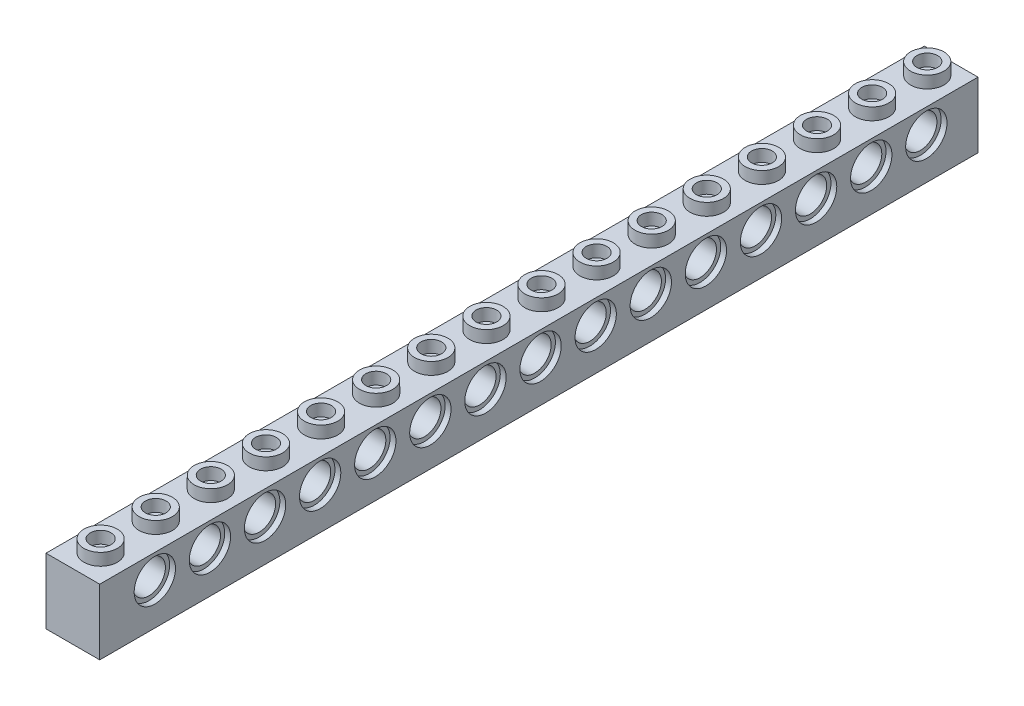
SolidWorks part; units mm, degrees
ref_plane "Front Plane" through (0, 0, 0) normal (0, 0, 1) x (1, 0, 0)
ref_plane "Top Plane" through (0, 0, 0) normal (0, 1, 0) x (1, 0, 0)
ref_plane "Right Plane" through (0, 0, 0) normal (1, 0, 0) x (0, 0, -1)
sketch "Sketch1" plane through (0, 0, 0) normal (0, 0, 1) x (1, 0, 0)
  line L1 (3.9, -4.76) -> (-3.9, -4.76)
  line L2 (3.9, -4.76) -> (3.9, 4.76)
  line L3 (3.9, 4.76) -> (-3.9, 4.76)
  line L4 (-3.9, -4.76) -> (-3.9, 4.76)
  line L5 (3.9, -4.76) -> (-3.9, 4.76) construction
  line L6 (3.9, 4.76) -> (-3.9, -4.76) construction
  point P0 (0, 0)
  dimension "D1" = 7.8
  dimension "D2" = 9.52
extrude "Boss-Extrude1" add sketch "Sketch1" along normal blind 127.5
sketch "Sketch2" plane through (0, 4.76, 0) normal (0, 1, 0) x (1, 0, 0)
  line L0 (0, -128.225) -> (0, 1.6736) construction
  line L1 (3.9, 0) -> (-3.9, 0) construction
  circle A0 centre (0, -3.47) radius 2.425
  circle A1 centre (0, -3.47) radius 1.5
  dimension "D1" = 4.85
  dimension "D2" = 3
  dimension "D3" = 3.47
extrude "Boss-Extrude3" add sketch "Sketch2" along normal blind 1.75
sketch "Sketch3" plane through (0, 4.76, 0) normal (0, 1, 0) x (1, 0, 0)
  line L0 (0, 0) -> (0, -127.5) construction
  line L1 (3.9, -127.5) -> (-3.9, -127.5) construction
pattern_linear "LPattern1" count 16 spacing 8 along (0, 0, 1) of "Boss-Extrude3"
sketch "Sketch4" plane through (3.9, 0, 0) normal (1, 0, 0) x (0, 0, -1)
  line L0 (-127.5, 1.26) -> (2.6817, 1.26) construction
  line L1 (-127.5, -4.76) -> (-127.5, 4.76) construction
  line L2 (-127.5, 4.76) -> (0, 4.76) construction
  line L3 (0, -4.76) -> (0, 4.76) construction
  line L4 (-7.5, 1.26) -> (-7.5, 12.5071) construction
  circle A0 centre (-7.5, 1.26) radius 3
  dimension "D2" = 6
  dimension "D1" = 3.5
  dimension "D3" = 7.5
extrude "Cut-Extrude1" cut sketch "Sketch4" against normal blind 0.85
sketch "Sketch5" plane through (-3.9, 0, 0) normal (-1, 0, 0) x (0, 0, 1)
  circle A0 centre (7.5, 1.26) radius 3
  dimension "D1" = 6
extrude "Cut-Extrude2" cut sketch "Sketch5" against normal blind 0.85
sketch "Sketch6" plane through (3.05, 0, 0) normal (1, 0, 0) x (0, 0, -1)
  circle A0 centre (-7.5, 1.26) radius 2.385
  dimension "D1" = 4.77
extrude "Cut-Extrude3" cut sketch "Sketch6" against normal through all
sketch "Sketch7" plane through (3.9, 0, 0) normal (1, 0, 0) x (0, 0, -1)
  line L0 (0, 1.26) -> (-134.9565, 1.26) construction
  line L1 (0, -4.76) -> (0, 4.76) construction
pattern_linear "LPattern2" count 15 spacing 8 along (0, 0, 1) of "Cut-Extrude1", "Cut-Extrude2"
pattern_linear "LPattern3" count 15 spacing 8 along (0, 0, 1) of "Cut-Extrude3"
sketch "Sketch10" plane through (0, -4.76, 0) normal (0, -1, 0) x (1, 0, 0)
  line L0 (-3.9, 127.5) -> (3.9, 127.5) construction
  line L1 (-2.45, 126.05) -> (2.45, 126.05)
  line L2 (-2.45, 126.05) -> (-2.45, 1.45)
  line L3 (-2.45, 1.45) -> (2.45, 1.45)
  line L4 (2.45, 126.05) -> (2.45, 1.45)
  line L5 (3.9, 127.5) -> (3.9, 0) construction
  line L6 (-3.9, 127.5) -> (-3.9, 0) construction
  line L7 (-3.9, 0) -> (3.9, 0) construction
  dimension "D1" = 1.45
  dimension "D2" = 1.45
  dimension "D3" = 1.45
  dimension "D4" = 1.45
extrude "Cut-Extrude4" cut sketch "Sketch10" against normal blind 3
sketch "Sketch11" plane through (0, -4.76, 0) normal (0, -1, 0) x (1, 0, 0)
  line L0 (-3.05, 119.5) -> (5.0334, 119.5) construction
  line L1 (-3.05, 122.5) -> (-3.05, 116.5) construction
  line L2 (0, 126.05) -> (0, 112.4393) construction
  line L3 (2.45, 126.05) -> (-2.45, 126.05) construction
  circle A0 centre (0, 119.5) radius 1.5
  dimension "D1" = 3
extrude "Boss-Extrude8" add sketch "Sketch11" against normal up to next
sketch "Sketch12" plane through (0, -1.76, 0) normal (0, -1, 0) x (1, 0, 0)
  line L0 (0, 127.5) -> (0, -4.2779) construction
  line L1 (-3.9, 127.5) -> (3.9, 127.5) construction
pattern_linear "LPattern4" count 15 spacing 8 along (0, 0, -1) of "Boss-Extrude8"
